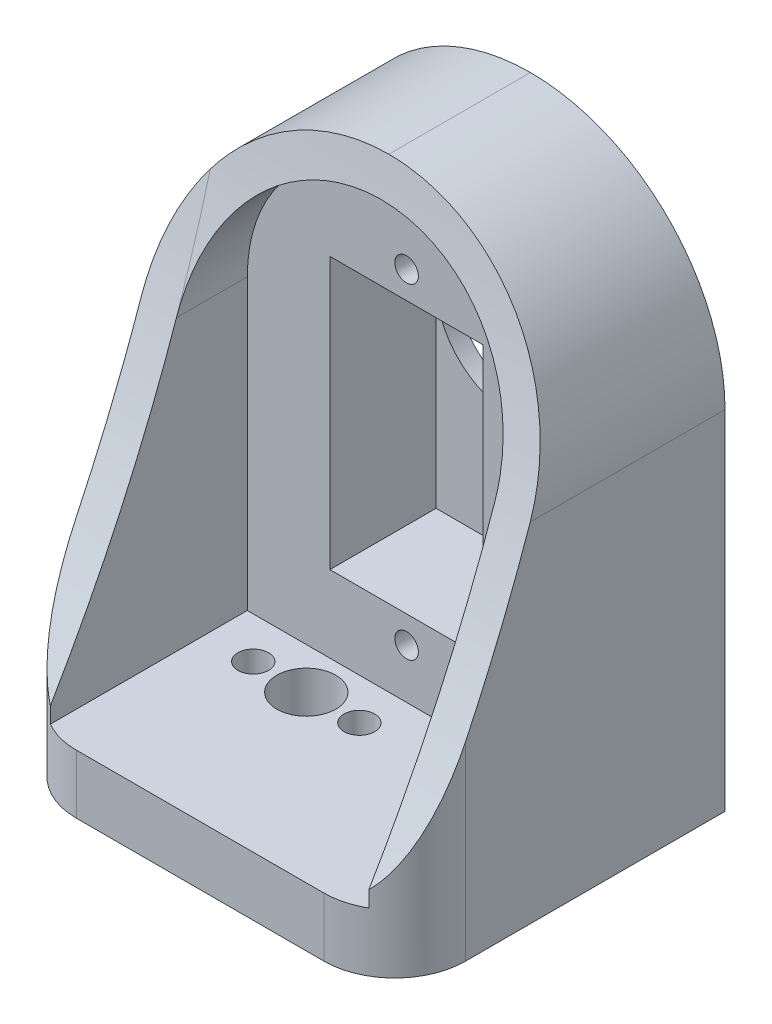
SolidWorks part; units mm, degrees
ref_plane "Front Plane" through (0, 0, 0) normal (0, 0, 1) x (1, 0, 0)
ref_plane "Top Plane" through (0, 0, 0) normal (0, 1, 0) x (1, 0, 0)
ref_plane "Right Plane" through (0, 0, 0) normal (1, 0, 0) x (0, 0, -1)
sketch "Sketch1" plane through (0, 0, 0) normal (0, 1, 0) x (1, 0, 0)
  line L1 (-16.5, -14) -> (16.5, -14)
  line L2 (-16.5, -14) -> (-16.5, 14)
  line L3 (-16.5, 14) -> (16.5, 14)
  line L4 (16.5, -14) -> (16.5, 14)
  line L5 (-16.5, -14) -> (16.5, 14) construction
  line L6 (-16.5, 14) -> (16.5, -14) construction
  point P0 (0, 0)
  dimension "D1" = 33
  dimension "D2" = 28
extrude "Boss-Extrude1" add sketch "Sketch1" along normal blind 46
sketch "Sketch3" plane through (16.5, 0, 0) normal (1, 0, 0) x (0, 0, -1)
  line L2 (-14, 0) -> (14, 0) construction
  line L3 (14, 46) -> (11.5, 46)
  line L4 (14, 46) -> (14, 21)
  line L5 (14, 21) -> (11.5, 21)
  line L6 (11.5, 46) -> (11.5, 21)
  line L7 (-14, 46) -> (3.5, 46)
  line L8 (-14, 46) -> (-14, 5)
  line L9 (-14, 5) -> (3.5, 5)
  line L10 (3.5, 46) -> (3.5, 5)
  dimension "D1" = 5
  dimension "D2" = 8
  dimension "D3" = 2.5
  dimension "D4" = 25
extrude "Cut-Extrude2" cut sketch "Sketch3" against normal through all contours L10 L9 M11 M12
sketch "Sketch4" plane through (0, 0, 0) normal (0, -1, 0) x (1, 0, 0)
  line L0 (-16.5, -14) -> (-16.5, 14) construction
  circle A0 centre (-5, 0) radius 2.5
  dimension "D2" = 5
  dimension "D1" = 11.5
extrude "Cut-Extrude3" cut sketch "Sketch4" against normal up to surface (5 mm away)
sketch "Sketch5" plane through (16.5, 0, 0) normal (1, 0, 0) x (0, 0, -1)
  line L0 (3.5, 46) -> (2, 46)
  line L1 (3.5, 46) -> (3.5, 5)
  line L2 (3.5, 5) -> (-14, 5)
  spline S0 degree 2 poles (2, 46) (-2.5316, 23.9681) (-14, 5) knots 0 0 0 1 1 1
  dimension "D1" = 1.5
extrude "Boss-Extrude2" add sketch "Sketch5" against normal blind 3
sketch "Sketch6" plane through (-16.5, 0, 0) normal (-1, 0, 0) x (0, 0, 1)
  line L3 (-2, 46) -> (-3.5, 46)
  line L4 (-3.5, 46) -> (-3.5, 5)
  line L5 (-3.5, 5) -> (14, 5)
  line L6 (-2, 46) -> (-3.5, 46)
  line L7 (-3.5, 46) -> (-3.5, 5)
  line L8 (-3.5, 5) -> (14, 5)
  parabola Q1
  parabola Q2
  dimension "D1" = 0
extrude "Boss-Extrude3" add sketch "Sketch6" against normal blind 3
sketch "Sketch8" plane through (13.5, 0, 0) normal (-1, 0, 0) x (0, 0, 1)
  line L0 (-3.5, 43) -> (-1.3475, 43)
  line L1 (-3.5, 5) -> (-3.5, 46) construction
  line L2 (-3.5, 46) -> (-2, 46) construction
  line L6 (-2, 46) -> (-3.5, 46)
  line L7 (-3.5, 46) -> (-3.5, 5)
  line L8 (-3.5, 5) -> (14, 5)
  line L9 (-2, 46) -> (-3.5, 46)
  line L10 (-3.5, 46) -> (-3.5, 5)
  line L11 (-3.5, 5) -> (14, 5)
  parabola Q0 construction
  parabola Q2
  parabola Q3
  dimension "D1" = 3
  dimension "D2" = 0
extrude "Boss-Extrude4" add sketch "Sketch8" along normal up to surface (27 mm away) contours L0 M4 M2 M3
fillet "Fillet2" radius 13.5 2 edges
fillet "Fillet3" radius 16.5 2 edges at (-16.5, 46, -8) (16.5, 46, -8)
sketch "Sketch9" plane through (0, 0, -3.5) normal (0, 0, 1) x (1, 0, 0)
  line L0 (-13.5, 5) -> (13.5, 5) construction
  line L1 (-6.5, 11.5) -> (6.5, 11.5)
  line L2 (-6.5, 11.5) -> (-6.5, 34.5)
  line L3 (-6.5, 34.5) -> (6.5, 34.5)
  line L4 (6.5, 11.5) -> (6.5, 34.5)
  line L5 (-6.5, 11.5) -> (6.5, 34.5) construction
  line L6 (-6.5, 34.5) -> (6.5, 11.5) construction
  point P0 (0, 23)
  dimension "D1" = 13
  dimension "D2" = 23
  dimension "D3" = 6.5
extrude "Cut-Extrude4" cut sketch "Sketch9" against normal blind 9
sketch "Sketch10" plane through (0, 0, -12.5) normal (0, 0, 1) x (1, 0, 0)
  line L1 (6.5, 34.5) -> (-6.5, 34.5) construction
  circle A0 centre (0, 28) radius 6.5
  dimension "D1" = 13
  dimension "D2" = 6.5
extrude "Cut-Extrude5" cut sketch "Sketch10" against normal through all
sketch "Sketch11" plane through (0, 0, -3.5) normal (0, 0, 1) x (1, 0, 0)
  line L1 (6.5, 34.5) -> (0, 34.5) construction
  circle A0 centre (0, 36.8) radius 1
  circle A1 centre (0, 9.2) radius 1
  dimension "D1" = 27.6
  dimension "D2" = 2
  dimension "D3" = 2
  dimension "D4" = 2.3
extrude "Cut-Extrude6" cut sketch "Sketch11" against normal blind 8
sketch "Sketch12" plane through (0, 5, 0) normal (0, 1, 0) x (1, 0, 0)
  circle A0 centre (-9.5, 0) radius 1.3
  circle A1 centre (-0.5, 0) radius 1.3
  circle A2 centre (-5, 0) radius 2.5 construction
  dimension "D1" = 9
  dimension "D3" = 2.6
  dimension "D4" = 2.6
  dimension "D2" = 4.5
extrude "Cut-Extrude7" cut sketch "Sketch12" against normal through all
fillet "Fillet4" radius 6 2 edges at (-16.5, 2.5, 14) (16.5, 2.5, 14)
